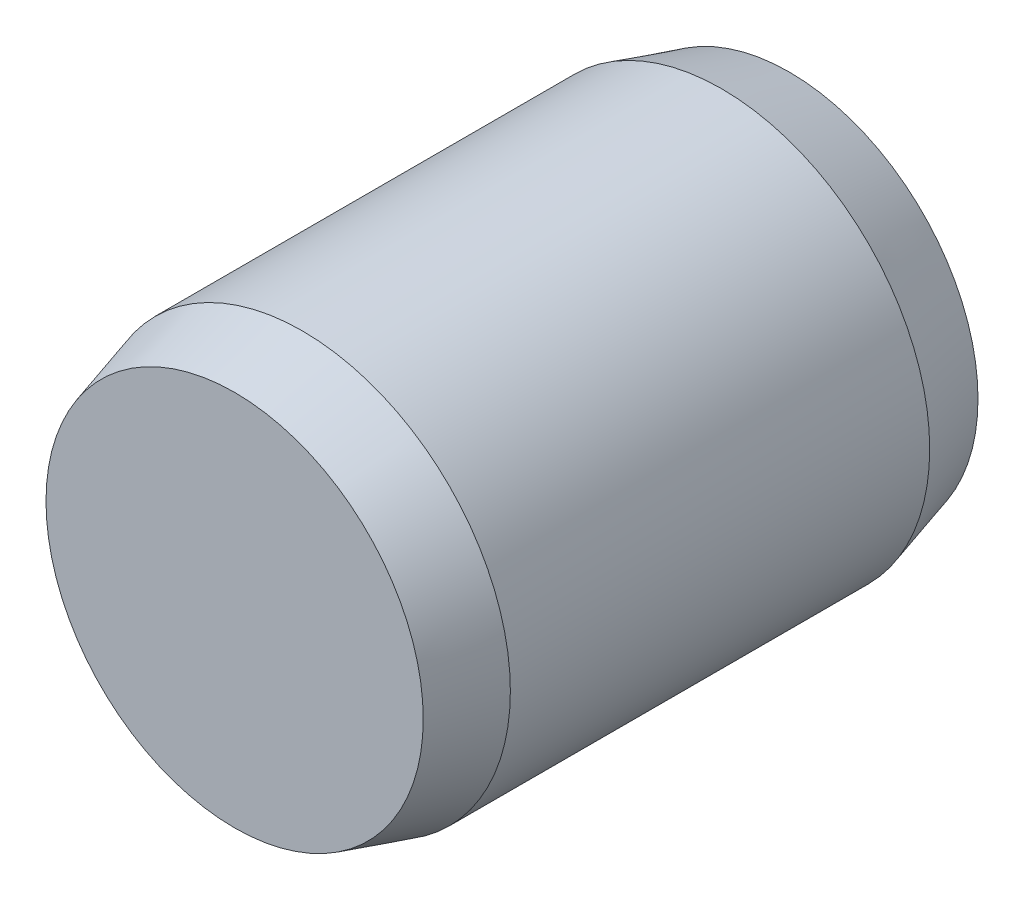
SolidWorks part; units mm, degrees
ref_plane "Front Plane" through (0, 0, 0) normal (0, 0, 1) x (1, 0, 0)
ref_plane "Top Plane" through (0, 0, 0) normal (0, 1, 0) x (1, 0, 0)
ref_plane "Right Plane" through (0, 0, 0) normal (1, 0, 0) x (0, 0, -1)
sketch "Sketch1" plane through (0, 0, 0) normal (0, 0, 1) x (1, 0, 0)
  circle A0 centre (0, 0) radius 2.3812
  point P3 (0, 2.3812)
  dimension "Diameter" = 4.7625
sketch "Sketch2" plane through (0, 0, 0) normal (1, 0, 0) x (0, 0, -1)
  line L0 (-3.175, 0) -> (3.175, 0) construction
  line L1 (-3.175, 0) -> (-3.175, 2.3812)
  line L2 (-3.175, 2.3812) -> (3.175, 2.3812)
  line L3 (3.175, 2.3812) -> (3.175, 0)
  line L4 (-3.175, 2.159) -> (-2.3999, 2.3812)
  line L5 (3.175, 2.159) -> (2.3999, 2.3812)
  dimension "Length" = 6.35
  dimension "Chamfer Angle" = 16
  dimension "Point Diameter" = 4.318
sketch "Sketch3" plane through (0, 0, 0) normal (1, 0, 0) x (0, 0, -1)
  line L0 (-3.175, 0) -> (3.175, 0) construction
  line L1 (3.175, 2.3812) -> (3.175, 0) construction
  line L2 (-3.175, 2.3812) -> (3.175, 2.3812) construction
  line L3 (-3.175, 0) -> (-3.175, 2.3812) construction
  line L4 (-3.175, 0) -> (3.175, 0)
  line L5 (3.175, 2.159) -> (3.175, 0)
  line L6 (-2.3999, 2.3812) -> (2.3999, 2.3812)
  line L7 (-3.175, 0) -> (-3.175, 2.159)
  line L8 (3.175, 2.159) -> (2.3999, 2.3812) construction
  line L9 (-3.175, 2.159) -> (-2.3999, 2.3812) construction
  line L10 (3.175, 2.159) -> (2.3999, 2.3812)
  line L11 (-3.175, 2.159) -> (-2.3999, 2.3812)
revolve "Revolve1" add sketch "Sketch3" angle 360 about L0
